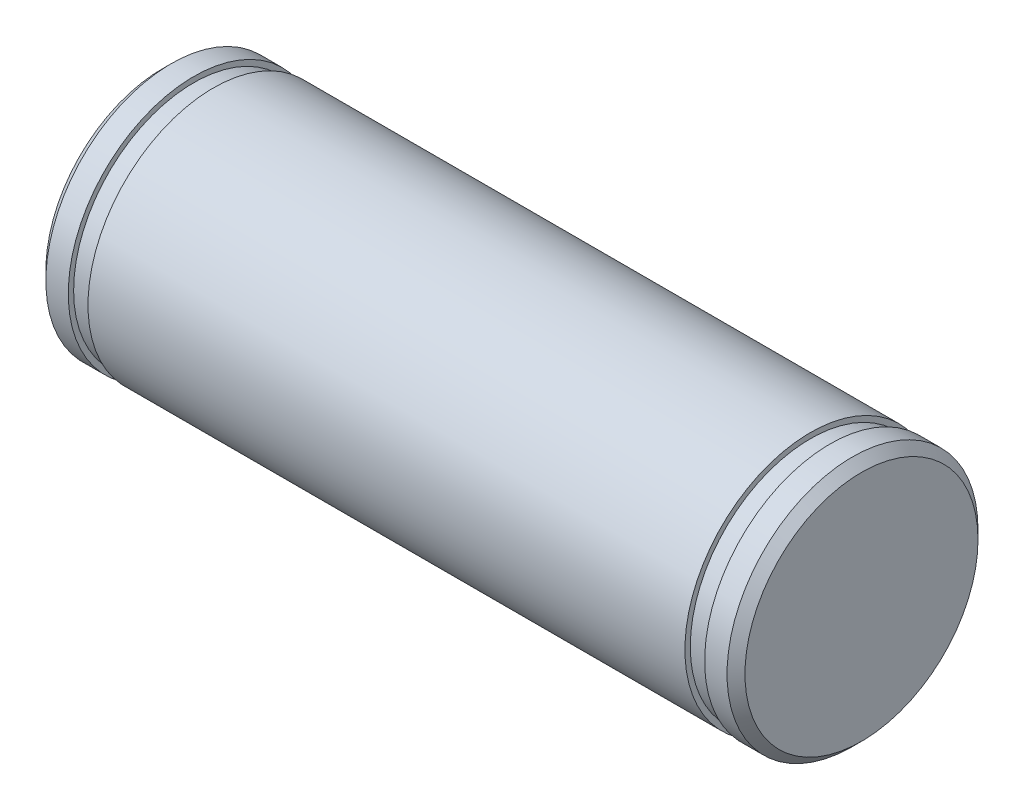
SolidWorks part; units mm, degrees
ref_plane "Plan de face" through (0, 0, 0) normal (0, 0, 1) x (1, 0, 0)
ref_plane "Plan de dessus" through (0, 0, 0) normal (0, 1, 0) x (1, 0, 0)
ref_plane "Plan de droite" through (0, 0, 0) normal (1, 0, 0) x (0, 0, -1)
sketch "Esquisse1" plane through (0, 0, 0) normal (0, 0, 1) x (1, 0, 0)
  line L0 (0, 0) -> (0, 6.5)
  line L1 (0, 6.5) -> (0.5, 7)
  line L2 (0.5, 7) -> (1.75, 7)
  line L3 (1.75, 7) -> (1.75, 6.7)
  line L4 (1.75, 6.7) -> (2.85, 6.7)
  line L5 (2.85, 6.7) -> (2.85, 7)
  line L6 (2.85, 7) -> (19.5, 7)
  line L7 (19.5, 7) -> (19.5, 0)
  line L8 (19.5, 0) -> (0, 0)
  dimension "D1" = 6.7
  dimension "D2" = 7
  dimension "D3" = 45
  dimension "D4" = 0.5
  dimension "D5" = 19.5
  dimension "D6" = 1.75
  dimension "D7" = 1.1
revolve "Révolution2" add sketch "Esquisse1" angle 360 about L8
mirror "Symétrie1" about plane through (19.5, 7, 0) normal (1, 0, 0) of "Révolution2"
